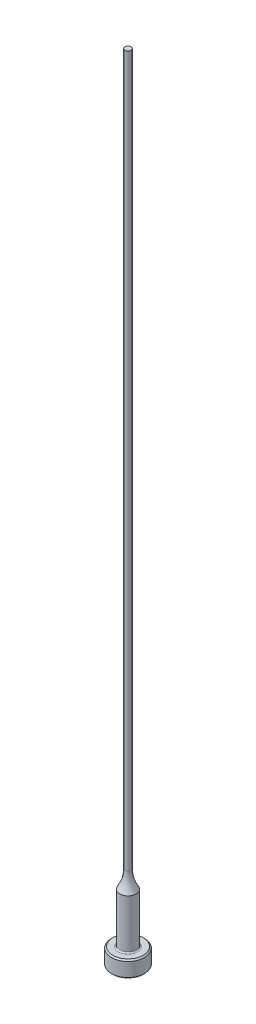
SolidWorks part; units mm, degrees
ref_plane "Front Plane" through (0, 0, 0) normal (0, 0, 1) x (1, 0, 0)
ref_plane "Top Plane" through (0, 0, 0) normal (0, 1, 0) x (1, 0, 0)
ref_plane "Right Plane" through (0, 0, 0) normal (1, 0, 0) x (0, 0, -1)
sketch "Sketch1" plane through (0, 0, 0) normal (0, 0, 1) x (1, 0, 0)
  line L0 (0, 259.9588) -> (0, -15.1925) construction
  line L1 (0, 0) -> (-3.175, 0)
  line L2 (-3.175, 0) -> (-3.175, 3.175)
  line L3 (-3.175, 3.175) -> (-1.5875, 3.175)
  line L4 (-0.5944, 16.1098) -> (-0.5944, 152.4)
  line L5 (-0.5944, 152.4) -> (0, 152.4)
  line L6 (0, 152.4) -> (0, 0)
  line L7 (-1.5875, 3.175) -> (-1.5875, 12.7)
  arc A0 (-1.5875, 12.7) -> (-0.5944, 16.1098) centre (-6.9444, 16.1098) ccw
  point P13 (-1.5875, 0)
  dimension "D1" = 6.35
  dimension "L" = 152.4
  dimension "D2" = 3.175
  dimension "H" = 6.35
  dimension "T" = 3.175
  dimension "D" = 1.1887
  dimension "S" = 12.7
revolve "Revolve1" add sketch "Sketch1" angle 360 about L0
chamfer "Chamfer1" distance 0.254 angle 45 2 edges at (0, 3.175, 3.175) (0, 0, 3.175)
fillet "Fillet1" radius 0.254 1 edges at (0, 3.175, 1.5875)
